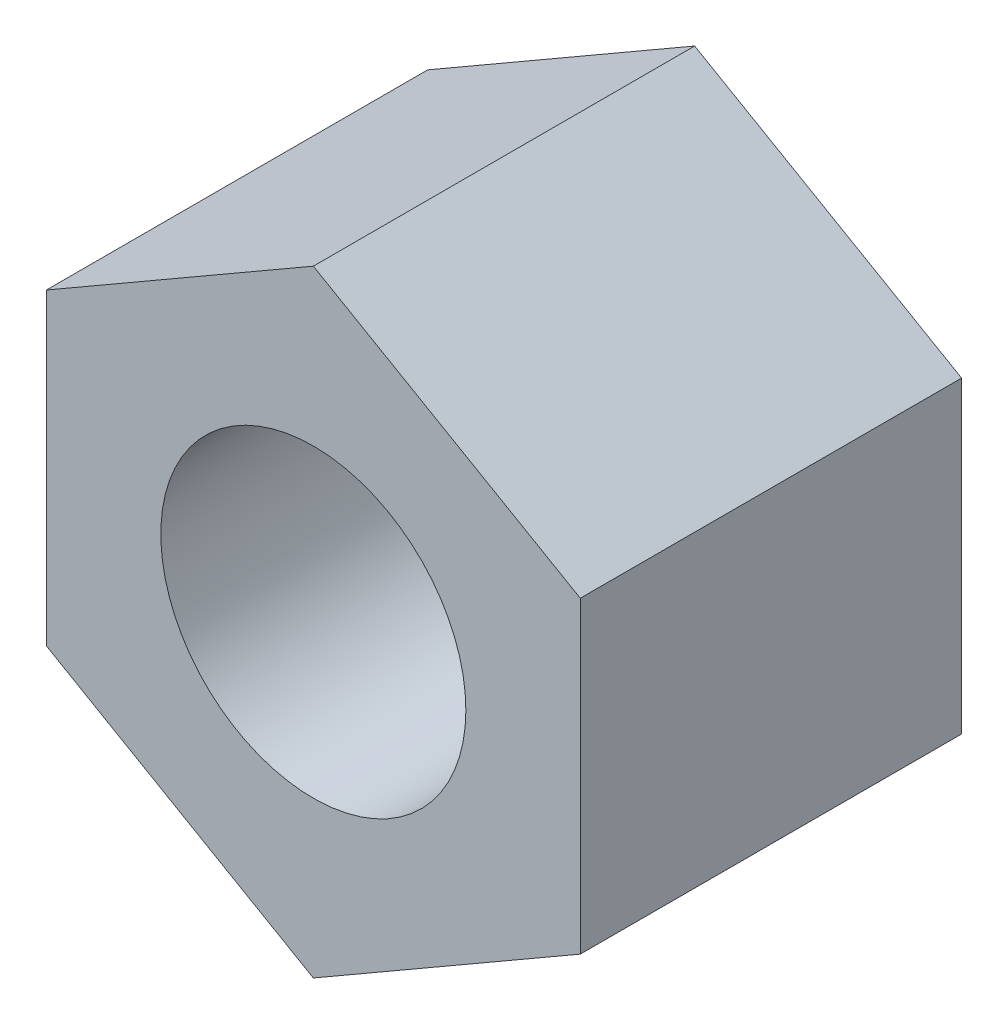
SolidWorks part; units mm, degrees
ref_plane "前视基准面" through (0, 0, 0) normal (0, 0, 1) x (1, 0, 0)
ref_plane "上视基准面" through (0, 0, 0) normal (0, 1, 0) x (1, 0, 0)
ref_plane "右视基准面" through (0, 0, 0) normal (1, 0, 0) x (0, 0, -1)
other "Configuration Table"
sketch "草图1" plane through (0, 0, 0) normal (0, 0, 1) x (1, 0, 0)
  line L0 (3.5, 2.0207) -> (0, 4.0415)
  line L1 (0, 4.0415) -> (-3.5, 2.0207)
  line L2 (-3.5, 2.0207) -> (-3.5, -2.0207)
  line L3 (-3.5, -2.0207) -> (0, -4.0415)
  line L4 (0, -4.0415) -> (3.5, -2.0207)
  line L5 (3.5, -2.0207) -> (3.5, 2.0207)
  circle A0 centre (0, 0) radius 2
  dimension "D1" = 4
  dimension "D2" = 3.5
  dimension "D3" = 2.0207
  dimension "D4" = 4.0415
extrude "Unthreaded_nominal_nut" add sketch "草图1" along normal blind 5
